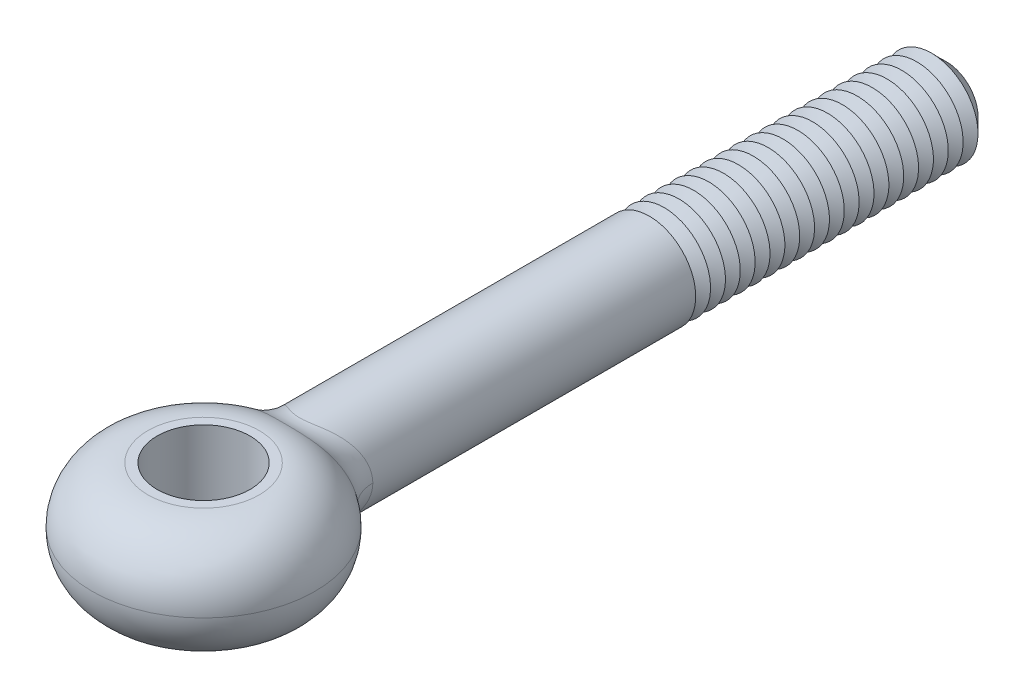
SolidWorks part; units mm, degrees
ref_plane "Front Plane" through (0, 0, 0) normal (0, 0, 1) x (1, 0, 0)
ref_plane "Top Plane" through (0, 0, 0) normal (0, 1, 0) x (1, 0, 0)
ref_plane "Right Plane" through (0, 0, 0) normal (1, 0, 0) x (0, 0, -1)
sketch "Sketch7" plane through (0, 0, 0) normal (0, 1, 0) x (1, 0, 0)
  circle A0 centre (0, 0) radius 6
  dimension "D1" = 12
extrude "Boss-Extrude3" add sketch "Sketch7" along normal mid plane 6
sketch "Sketch8" plane through (0, 0, 0) normal (0, 0, 1) x (1, 0, 0)
  circle A0 centre (0, 0) radius 2.5
  dimension "D1" = 5
extrude "Boss-Extrude4" add sketch "Sketch8" against normal blind 40
fillet "Fillet5" radius 3 2 edges at (0, -3, 6) (0, 3, 6)
fillet "Fillet6" radius 2 2 edges at (0.0752, -2.4989, -4.6594) (-0.0752, 2.4989, -4.6594)
chamfer "Chamfer1" distance 0.8 angle 45 1 edges at (2.5, 0, -40)
sketch "Sketch10" plane through (0, 0, 0) normal (0, 1, 0) x (1, 0, 0)
  line L0 (0, 28.1405) -> (0, -7.9233) construction
sketch "Sketch11" plane through (0, 0, 0) normal (0, 1, 0) x (1, 0, 0)
  line L0 (-2.5, 24) -> (-1.8072, 24.4)
  line L1 (-2.5, 39.2) -> (-2.5, 6.6144) construction
  line L2 (-1.8072, 24.4) -> (-2.5, 24.8)
  line L3 (-2.5, 24.8) -> (-2.5, 24)
  line L4 (1.7, 40) -> (-1.7, 40) construction
  dimension "D1" = 0.8
  dimension "D2" = 16
revolve "Cut-Revolve1" cut sketch "Sketch11" angle 360 about L0
pattern_linear "LPattern1" count 19 spacing 0.8 along (0, 0, -1) of "Cut-Revolve1"
sketch "Sketch12" plane through (0, 0, 0) normal (0, 1, 0) x (1, 0, 0)
  circle A0 centre (0, 0) radius 2.5
  dimension "D1" = 5
extrude "Cut-Extrude1" cut sketch "Sketch12" against normal mid plane 6
